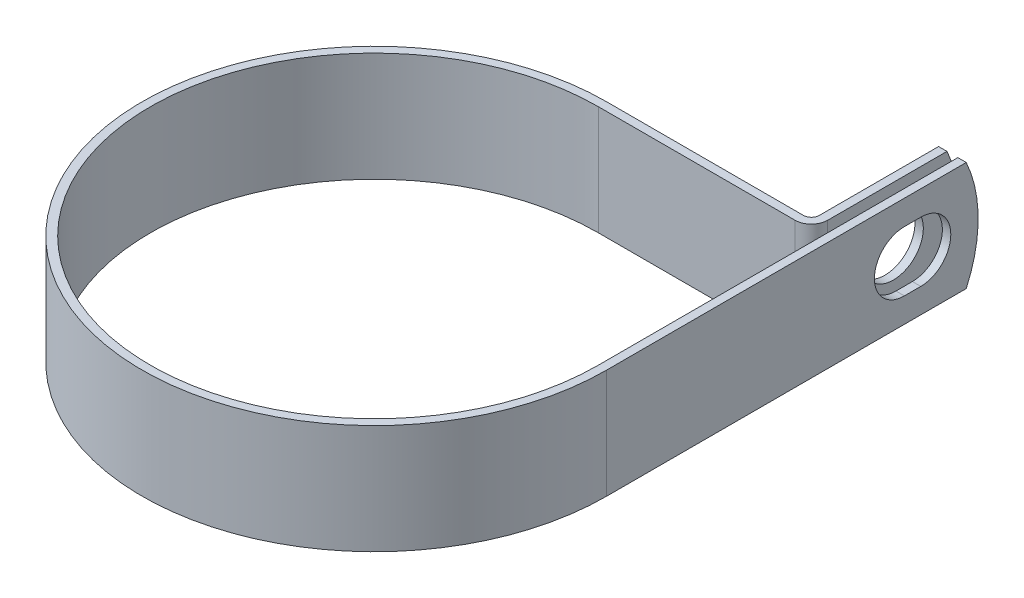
SolidWorks part; units mm, degrees
ref_plane "Front Plane" through (0, 0, 0) normal (0, 0, 1) x (1, 0, 0)
ref_plane "Top Plane" through (0, 0, 0) normal (0, 1, 0) x (1, 0, 0)
ref_plane "Right Plane" through (0, 0, 0) normal (1, 0, 0) x (0, 0, -1)
sketch "Sketch1" plane through (0, 0, 0) normal (0, 1, 0) x (1, 0, 0)
  line L0 (0, 32.5374) -> (28.5852, 32.5374)
  line L1 (32.5374, 0) -> (32.5374, 32.5374)
  line L2 (30.9626, 53.975) -> (30.9626, 34.9148)
  line L5 (32.5374, 32.5374) -> (32.5374, 53.975)
  arc A0 (0, 32.5374) -> (32.5374, 0) centre (0, 0) ccw
  arc A3 (28.5852, 32.5374) -> (30.9626, 34.9148) centre (28.5852, 34.9148) ccw
extrude "Extrude-Thin1" add sketch "Sketch1" along normal mid plane 15.875 thin
sketch "Sketch2" plane through (29.7434, 0, 0) normal (-1, 0, 0) x (0, 0, 1)
  line L0 (-53.975, 7.9375) -> (-53.975, -7.9375) construction
  line L7 (0, 7.9375) -> (0, -7.9375) construction
  circle A0 centre (-44.45, 0) radius 4.3561
  point P2 (-53.975, 0)
extrude "Cut-Extrude1" cut sketch "Sketch2" against normal up to surface (1.2192 mm away)
sketch "Sketch3" plane through (33.7566, 0, 0) normal (1, 0, 0) x (0, 0, -1)
  line L0 (43.2562, 0) -> (45.6438, 0) construction
  line L1 (43.2562, 4.3561) -> (45.6438, 4.3561)
  line L2 (43.2562, -4.3561) -> (45.6438, -4.3561)
  line L3 (53.975, 7.9375) -> (53.975, -7.9375) construction
  arc A0 (43.2562, 4.3561) -> (43.2562, -4.3561) centre (43.2562, 0) ccw
  arc A1 (45.6438, -4.3561) -> (45.6438, 4.3561) centre (45.6438, 0) ccw
  point P3 (44.45, 0)
  point P8 (53.975, 0)
  point P11 (38.9001, 0)
  point P12 (49.9999, 0)
extrude "Cut-Extrude2" cut sketch "Sketch3" against normal up to surface (1.2192 mm away)
sketch "Sketch4" plane through (29.7434, 0, 0) normal (-1, 0, 0) x (0, 0, 1)
  line L0 (-53.975, 7.9375) -> (-53.975, -7.9375)
  line L1 (-53.975, 7.9375) -> (-52.2426, 7.9375)
  line L2 (-53.975, 7.9375) -> (-34.9148, 7.9375) construction
  line L3 (-53.975, -7.9375) -> (-52.2426, -7.9375)
  line L4 (-53.975, -7.9375) -> (-34.9148, -7.9375) construction
  arc A0 (-52.2426, 7.9375) -> (-52.2426, -7.9375) centre (-34.925, 0) ccw
extrude "Cut-Extrude3" cut sketch "Sketch4" against normal through all contours A0 M4 M5 | A0 L0 M2
equation "\"D1@Sketch3\" = \"D2@Sketch2\""
equation "\"D7@Sketch1\" = \"D3@Sketch2\" + \"D1@Sketch3\""
equation "\"D1@Sketch4\" = ( \"D1@Extrude-Thin1\" + .125 ) * 2"
equation "\"D2@Sketch1\"=1.95*\"D5@Extrude-Thin1\""
equation "\"D2@Sketch3\" = \"D1@Sketch2\""
